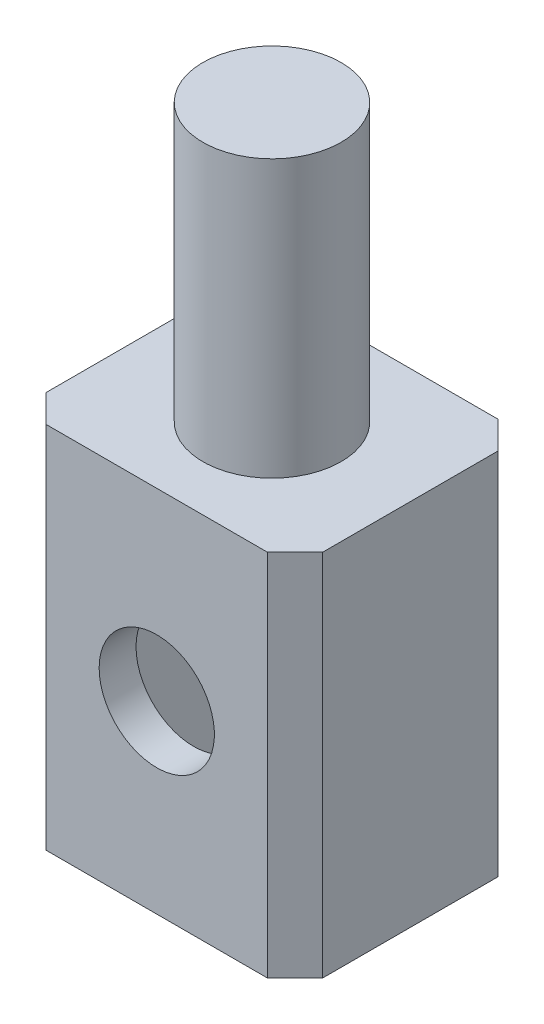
SolidWorks part; units mm, degrees
ref_plane "Front Plane" through (0, 0, 0) normal (0, 0, 1) x (1, 0, 0)
ref_plane "Top Plane" through (0, 0, 0) normal (0, 1, 0) x (1, 0, 0)
ref_plane "Right Plane" through (0, 0, 0) normal (1, 0, 0) x (0, 0, -1)
sketch "Sketch1" plane through (0, 0, 0) normal (0, 1, 0) x (1, 0, 0)
  line L1 (0, 0) -> (76.2, 0)
  line L2 (0, 0) -> (0, 63.5)
  line L3 (0, 63.5) -> (76.2, 63.5)
  line L4 (76.2, 0) -> (76.2, 63.5)
  dimension "D1" = 76.2
  dimension "D2" = 63.5
extrude "Boss-Extrude1" add sketch "Sketch1" along normal blind 101.6
shell "Shell3" thickness 10.16
sketch "Sketch2" plane through (0, 101.6, 0) normal (0, 1, 0) x (1, 0, 0)
  circle A0 centre (38.1, 31.75) radius 19.05
  dimension "D1" = 38.1
extrude "Boss-Extrude2" add sketch "Sketch2" along normal blind 76.2
chamfer "Chamfer2" distance 7.62 angle 45 4 edges at (0, 50.8, 0) (0, 50.8, -63.5) (76.2, 50.8, -63.5) (76.2, 50.8, 0)
sketch "Sketch3" plane through (0, 0, 0) normal (0, 0, 1) x (1, 0, 0)
  circle A0 centre (38.1, 50.8) radius 15.875
  dimension "D1" = 31.75
extrude "Cut-Extrude1" cut sketch "Sketch3" against normal blind 19.05 and the other way through all
ref_plane "Plane1" through (0, 0, 0) normal (0, 0, 1) x (1, 0, 0)
